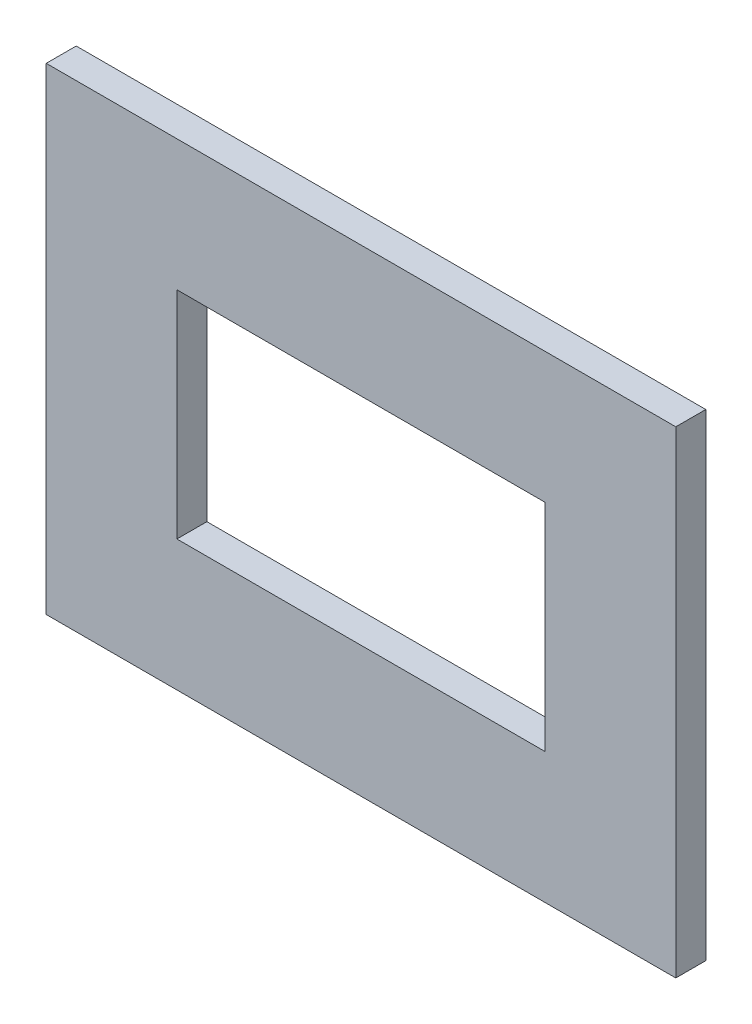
SolidWorks part; units mm, degrees
ref_plane "Front Plane" through (0, 0, 0) normal (0, 0, 1) x (1, 0, 0)
ref_plane "Top Plane" through (0, 0, 0) normal (0, 1, 0) x (1, 0, 0)
ref_plane "Right Plane" through (0, 0, 0) normal (1, 0, 0) x (0, 0, -1)
sketch "Sketch1" plane through (0, 0, 0) normal (0, 0, 1) x (1, 0, 0)
  line L1 (92.075, -53.975) -> (-92.075, -53.975)
  line L2 (92.075, -53.975) -> (92.075, 53.975)
  line L3 (92.075, 53.975) -> (-92.075, 53.975)
  line L4 (-92.075, -53.975) -> (-92.075, 53.975)
  line L5 (92.075, -53.975) -> (-92.075, 53.975) construction
  line L6 (92.075, 53.975) -> (-92.075, -53.975) construction
  line L7 (-639.1231, 371.2771) -> (768.3621, 371.2771)
  line L8 (-639.1231, 371.2771) -> (-639.1231, -757.682)
  line L9 (-639.1231, -757.682) -> (768.3621, -757.682)
  line L10 (768.3621, 371.2771) -> (768.3621, -757.682)
  point P0 (0, 0)
  dimension "D1" = 184.15
  dimension "D2" = 107.95
extrude "Boss-Extrude1" add sketch "Sketch1" along normal blind 15
sketch "Sketch2" plane through (0, 0, 0) normal (0, 0, -1) x (-1, 0, 0)
  line L1 (-834.5725, 454.6118) -> (800.2783, 454.6118)
  line L2 (-834.5725, 454.6118) -> (-834.5725, -959.418)
  line L3 (-834.5725, -959.418) -> (800.2783, -959.418)
  line L4 (800.2783, 454.6118) -> (800.2783, -959.418)
  line L5 (-483.8012, 163.765) -> (192.9837, 163.765)
  line L6 (-483.8012, 163.765) -> (-483.8012, -297.4311)
  line L7 (-483.8012, -297.4311) -> (192.9837, -297.4311)
  line L8 (192.9837, 163.765) -> (192.9837, -297.4311)
extrude "Cut-Extrude1" cut sketch "Sketch2" against normal through all
sketch "Sketch3" plane through (0, 0, 0) normal (0, 0, -1) x (-1, 0, 0)
  line L0 (192.9837, 163.765) -> (-435.3614, 114.675)
  line L1 (-435.3614, 114.675) -> (-435.3614, -297.4311)
  line L2 (-483.8012, -297.4311) -> (192.9837, -297.4311) construction
  line L3 (-435.3614, -297.4311) -> (192.9837, -248.3411)
  line L4 (192.9837, -297.4311) -> (192.9837, 163.765) construction
  line L5 (192.9837, -248.3411) -> (192.9837, 163.765)
  line L7 (-661.732, 257.6517) -> (303.4764, 257.6517)
  line L8 (-661.732, 257.6517) -> (-661.732, -454.6636)
  line L9 (-661.732, -454.6636) -> (303.4764, -454.6636)
  line L10 (303.4764, 257.6517) -> (303.4764, -454.6636)
extrude "Cut-Extrude2" cut sketch "Sketch3" against normal blind 25
sketch "Sketch4" plane through (0, 0, 0) normal (0, 0, -1) x (-1, 0, 0)
  line L1 (-117.4391, -79.375) -> (117.4391, -79.375)
  line L2 (-117.4391, -79.375) -> (-117.4391, 79.375)
  line L3 (-117.4391, 79.375) -> (117.4391, 79.375)
  line L4 (117.4391, -79.375) -> (117.4391, 79.375)
  line L5 (-157.4391, -119.375) -> (157.4391, -119.375)
  line L6 (-157.4391, -119.375) -> (-157.4391, 119.375)
  line L7 (-157.4391, 119.375) -> (157.4391, 119.375)
  line L8 (157.4391, -119.375) -> (157.4391, 119.375)
  line L12 (-435.3614, -297.4311) -> (192.9837, -248.3411)
  line L13 (192.9837, -248.3411) -> (192.9837, 163.765)
  line L14 (192.9837, 163.765) -> (-435.3614, 114.675)
  line L15 (-435.3614, 114.675) -> (-435.3614, -297.4311)
  line L16 (-435.3614, -297.4311) -> (192.9837, -248.3411)
  line L17 (192.9837, -248.3411) -> (192.9837, 163.765)
  line L18 (192.9837, 163.765) -> (-435.3614, 114.675)
  line L19 (-435.3614, 114.675) -> (-435.3614, -297.4311)
  dimension "D1" = 40
  dimension "D2" = 40
  dimension "D3" = 40
  dimension "D4" = 40
  dimension "D5" = 0
extrude "Cut-Extrude3" cut sketch "Sketch4" against normal through all contours L8 L5 L6 L7 M12 M9 M10 M11
